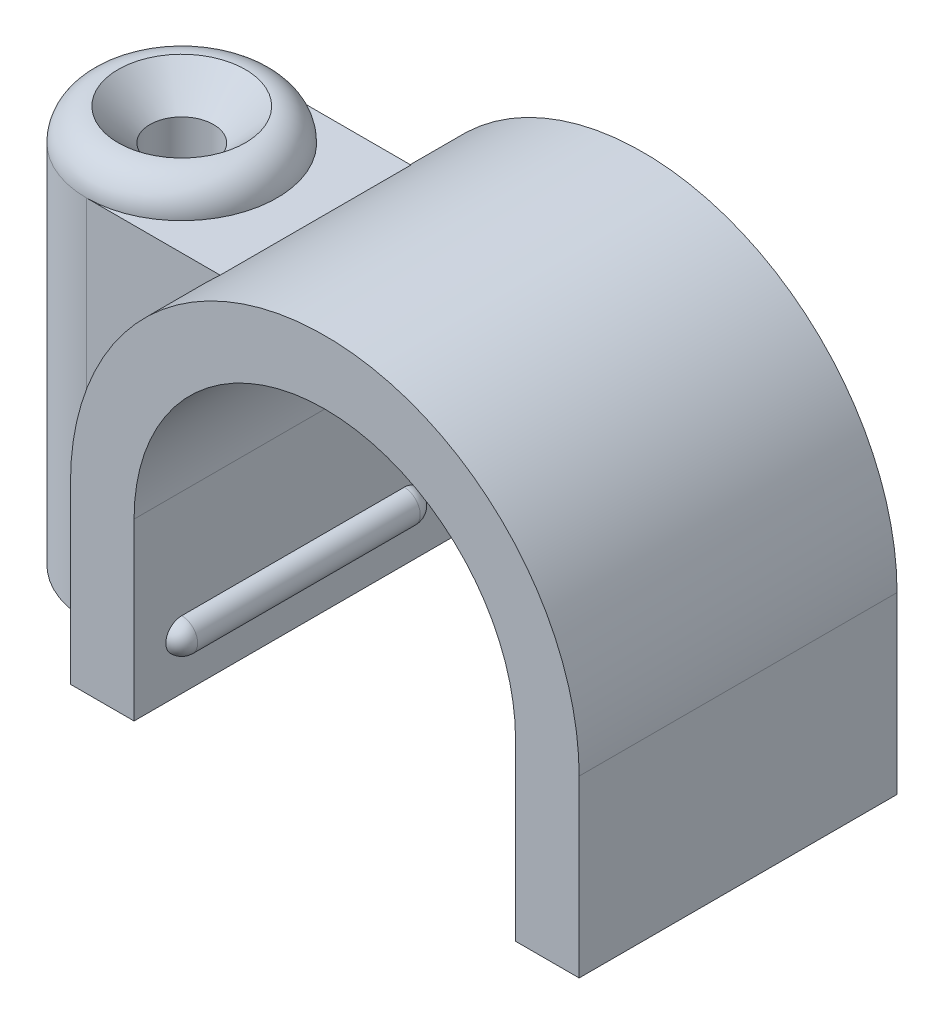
SolidWorks part; units mm, degrees
ref_plane "face" through (0, 0, 0) normal (0, 0, 1) x (1, 0, 0)
ref_plane "dessus" through (0, 0, 0) normal (0, 1, 0) x (1, 0, 0)
ref_plane "profil" through (0, 0, 0) normal (1, 0, 0) x (0, 0, -1)
sketch "Esquisse1" plane through (0, 0, 0) normal (0, 0, 1) x (1, 0, 0)
  line L0 (14, 0) -> (14, 5.5)
  line L1 (2, 0) -> (2, 5.5)
  line L2 (0, 0) -> (0, 5.5)
  line L3 (0, 0) -> (2, 0)
  line L4 (16, 0) -> (16, 5.5)
  line L5 (14, 0) -> (16, 0)
  arc A0 (0, 5.5) -> (16, 5.5) centre (8, 5.5) cw
  arc A1 (2, 5.5) -> (14, 5.5) centre (8, 5.5) cw
  dimension "D4" = 2
  dimension "D3" = 5.5
  dimension "D1" = 16
  dimension "D2" = 5.5
extrude "Base-Extrusion" add sketch "Esquisse1" against normal blind 10
sketch "Esquisse10" plane through (0, 0, 0) normal (0, -1, 0) x (1, 0, 0)
  line L0 (14, 0) -> (2, 0) construction
  line L1 (2, -10) -> (2, 0) construction
  circle A0 centre (-1.5, -5) radius 3
  dimension "D1" = 6
  dimension "D2" = 5
  dimension "D3" = 3.5
extrude "Boss.-Extru.5" add sketch "Esquisse10" against normal blind 12.5
ref_plane "Plan1" through (-1.5, 0, 0) normal (1, 0, 0) x (0, 0, -1)
sketch "Esquisse4" plane through (-1.5, 0, 0) normal (1, 0, 0) x (0, 0, -1)
  line L0 (10, 5.5) -> (10, 0) construction
  line L1 (8, 0) -> (2, 0)
  line L2 (8, 0) -> (8, 11.5)
  line L3 (8, 11.5) -> (2, 11.5)
  line L4 (2, 0) -> (2, 11.5)
  dimension "D1" = 11.5
  dimension "D2" = 6
  dimension "D3" = 2
extrude "Boss.-Extru.3" add sketch "Esquisse4" along normal up to next
ref_plane "Plan2" through (0, 0, -5) normal (0, 0, 1) x (1, 0, 0)
fillet "Congé3" radius 1
hole_wizard "Perçage1" positions "Esquisse12" profile "Esquisse11" countersink size "M2" standard "Ansi Métrique"
sketch "Esquisse12" plane through (0, 12.5, 0) normal (0, 1, 0) x (-1, 0, 0)
  point P0 (1.5, -5)
sketch "Esquisse11" plane through (-1.5, 12.5, -5) normal (1, 0, 0) x (0, 0, 1)
  line L0 (0, 0) -> (0, 12.5)
  line L1 (0, 12.5) -> (1, 12.5)
  line L2 (1, 12.5) -> (1, 1)
  line L3 (1, 1) -> (2, 0)
  line L5 (2, 0) -> (0, 0)
  line L6 (-1, 1) -> (-2, 0) construction
  line L11 (0, -6.35) -> (0, 107.95) construction
  dimension "Diamètre du perçage jusqu'au prochain" = 2
  dimension "Profondeur du perçage jusqu'au prochain" = 12.5
  dimension "Diamètre du fraisage entrant" = 4
  dimension "Angle du fraisage entrant" = 90
sketch "Esquisse9" plane through (0, 0, -5) normal (0, 0, 1) x (1, 0, 0)
  line L4 (2, 0) -> (2, 5.5) construction
  line L6 (2, 2.1191) -> (2, 1.1191)
  arc A0 (2, 1.1191) -> (2, 2.1191) centre (2, 1.6191) ccw
  dimension "D1" = 1
extrude "Boss.-Extru.4" add sketch "Esquisse9" along normal mid plane 8
fillet "Congé5" radius 0.5
ref_plane "Plan3" through (8, 0, 0) normal (-1, 0, 0) x (0, 0, 1)
mirror "Symétrie1" about plane through (8, 0, 0) normal (-1, 0, 0)
